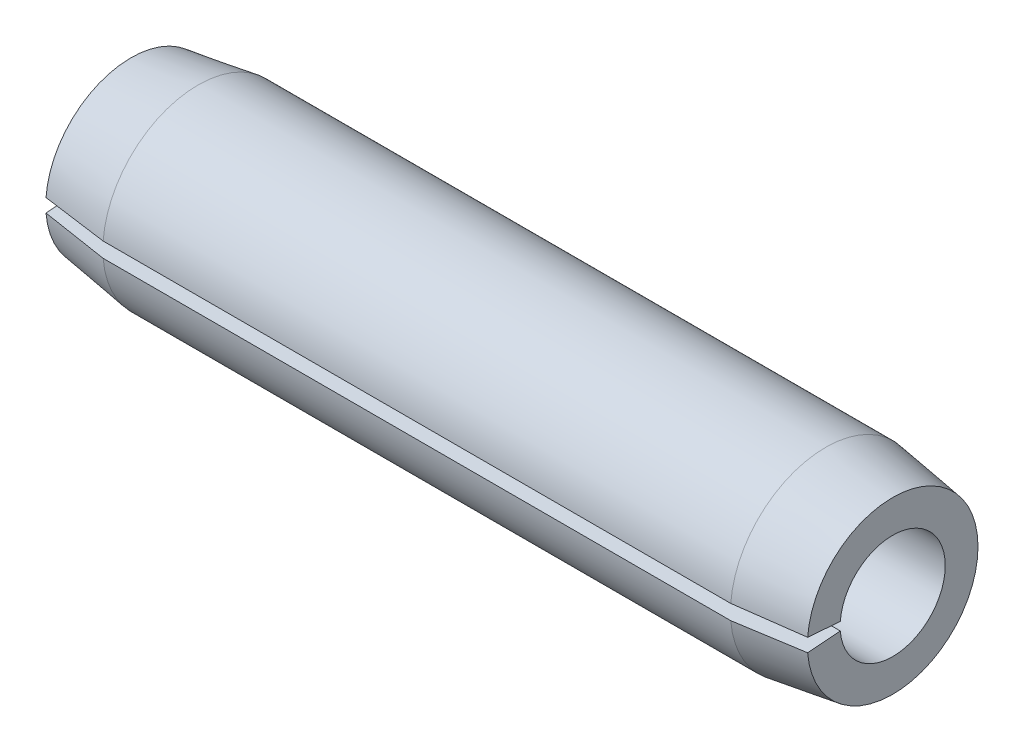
SolidWorks part; units mm, degrees
ref_plane "Plane1" through (0, 0, 0) normal (0, 0, 1) x (1, 0, 0)
ref_plane "Plane2" through (0, 0, 0) normal (0, 1, 0) x (1, 0, 0)
ref_plane "Plane3" through (0, 0, 0) normal (1, 0, 0) x (0, 0, -1)
sketch "Sketch1" plane through (0, 0, 0) normal (0, 0, 1) x (1, 0, 0)
  line L0 (-9.525, 0) -> (111.125, 0) construction
  line L1 (0, 0.8763) -> (12.7, 0.8763)
  line L2 (12.7, 0.8763) -> (12.7, 1.4224)
  line L3 (12.7, 1.4224) -> (11.5824, 1.5875)
  line L4 (11.5824, 1.5875) -> (1.1176, 1.5875)
  line L5 (1.1176, 1.5875) -> (0, 1.4224)
  line L7 (0, 1.4224) -> (0, 0.8763)
  dimension "Diameter" = 3.175
  dimension "Length" = 12.7
  dimension "Thickness" = 0.7112
  dimension "Top_ch_len" = 1.1176
  dimension "Bottom_ch_len" = 1.1176
  dimension "Bottom_ch_dia" = 2.8448
  dimension "Top_ch_dia" = 2.8448
revolve "Base-Revolve" add sketch "Sketch1" angle 360 about L0
sketch "Sketch2" plane through (0, 0, 0) normal (-1, 0, 0) x (0, -1, 0)
  line L0 (0, 0) -> (0.127, 1.6143)
  line L1 (0, -3.175) -> (0, 12.7) construction
  line L2 (0, 0) -> (-0.127, 1.6143)
  arc A0 (0.127, 1.6143) -> (-0.127, 1.6143) centre (0, 0) ccw
  dimension "D1" = 1.6193
  dimension "Gap_ang" = 9
extrude "Gap" cut sketch "Sketch2" against normal through all
equation "\"D1@Sketch2\" = \"Diameter@Sketch1\" * 0.51"
equation "' \"Bottom_ch_dia@Sketch1\" = \"Diameter@Sketch1\" -  ( \"Thickness@Sketch1\" / 2 ) "
equation "' \"Top_ch_dia@Sketch1\" = \"Bottom_ch_dia@Sketch1\""
equation "' \"Top_ch_len@Sketch1\" = \"Bottom_ch_len@Sketch1\""
